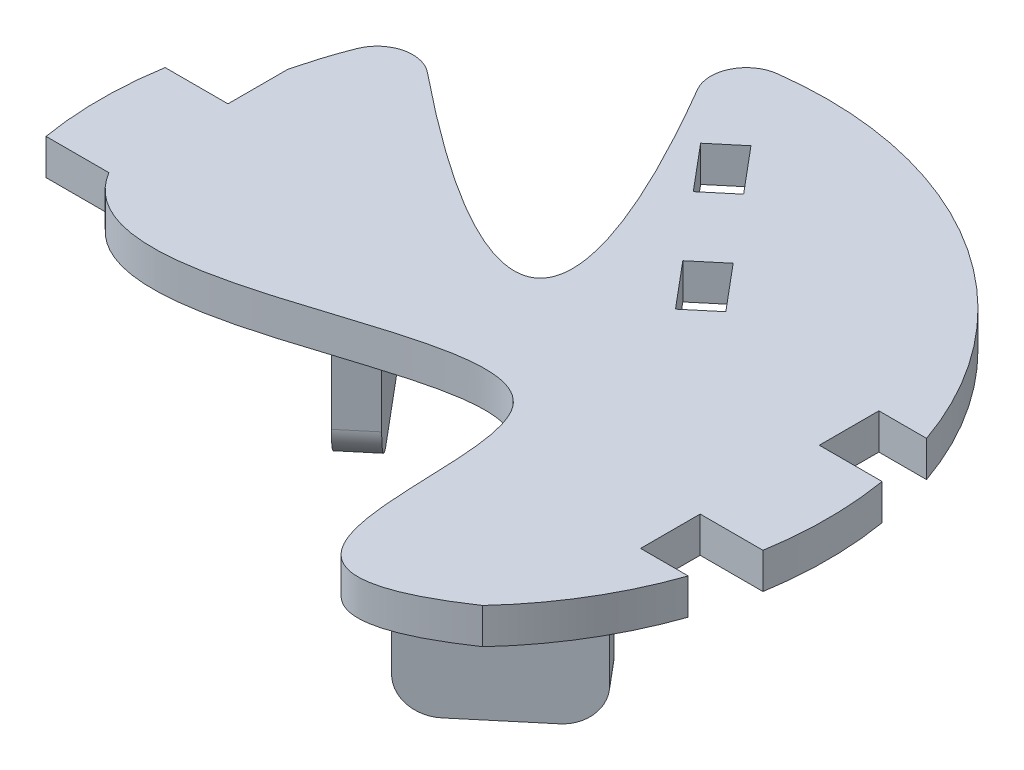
SolidWorks part; units mm, degrees
ref_plane "Alzado" through (0, 0, 0) normal (0, 0, 1) x (1, 0, 0)
ref_plane "Planta" through (0, 0, 0) normal (0, 1, 0) x (1, 0, 0)
ref_plane "Vista lateral" through (0, 0, 0) normal (1, 0, 0) x (0, 0, -1)
sketch "Croquis1" plane through (0, 0, 0) normal (0, 1, 0) x (1, 0, 0)
  circle A0 centre (0, 0) radius 30.5
extrude "Saliente-Extruir1" add sketch "Croquis1" along normal blind 3
sketch "Croquis5" plane through (0, 3, 0) normal (0, 1, 0) x (1, 0, 0)
  line L0 (0, 0) -> (0, 10)
  line L1 (28.8141, -5) -> (30.0874, -5)
  line L2 (28.8141, 5) -> (30.0874, 5)
  line L3 (-24.8141, 10) -> (-28.8141, 10)
  line L4 (24.8141, -5) -> (24.8141, -10)
  line L5 (-24.8141, -10) -> (-28.8141, -10)
  line L6 (24.8141, -5) -> (28.8141, -5)
  line L7 (24.8141, 5) -> (24.8141, 10)
  line L8 (-24.8141, 5) -> (-28.8141, 5)
  line L9 (-24.8141, 5) -> (-24.8141, 10)
  line L10 (-24.8141, -5) -> (-28.8141, -5)
  line L11 (-24.8141, -5) -> (-24.8141, -10)
  line L12 (24.8141, 5) -> (28.8141, 5)
  line L13 (24.8141, -10) -> (28.8141, -10)
  line L14 (24.8141, 10) -> (28.8141, 10)
  line L15 (-28.8141, 5) -> (-30.0874, 5)
  line L16 (-28.8141, -5) -> (-30.0874, -5)
  circle A1 centre (0, 0) radius 30.5 construction
  arc A2 (-28.8141, 10) -> (-30.0874, 5) centre (0, 0) ccw
  arc A3 (28.8141, 10) -> (28.8141, -10) centre (0, 0) cw
  arc A4 (-30.0874, -5) -> (-28.8141, -10) centre (0, 0) ccw
  arc A5 (30.0874, -5) -> (28.8141, -10) centre (0, 0) cw
  arc A6 (28.8141, 10) -> (30.0874, 5) centre (0, 0) cw
extrude "Cortar-Extruir3" cut sketch "Croquis5" against normal blind 4
sketch "Croquis9" plane through (0, 3, 0) normal (0, 1, 0) x (1, 0, 0)
  line L0 (7.2803, 10.7703) -> (22.8679, -7.8063)
  line L1 (-8.3073, 29.3469) -> (7.2803, 10.7703)
  line L2 (7.9714, 14.6138) -> (11.1854, 10.7835)
  line L3 (-24.8141, -5) -> (-24.8141, -10)
  line L4 (-24.8141, -10) -> (-28.8141, -10)
  line L5 (11.1854, 10.7835) -> (8.8872, 8.8552)
  line L7 (7.9714, 14.6138) -> (5.6733, 12.6854)
  line L11 (-2.1205, 21.9737) -> (1.0934, 18.1435)
  line L12 (0.1776, 23.902) -> (3.3916, 20.0718)
  line L13 (-24.8141, 10) -> (-28.8141, 10)
  line L14 (3.3916, 20.0718) -> (1.0934, 18.1435)
  line L15 (0.1776, 23.902) -> (-2.1205, 21.9737)
  arc A1 (28.8141, 10) -> (-28.8141, 10) centre (0, 0) ccw construction
  arc A5 (-28.8141, -10) -> (28.8141, -10) centre (0, 0) ccw construction
  arc A6 (-23.4189, 14.4323) -> (-18.7453, 15.6646) centre (-20.6289, 13.3296) cw
  arc A7 (-28.8141, -10) -> (22.3289, -20.7766) centre (0, 0) ccw
  arc A8 (-28.8141, 10) -> (-8.3073, 29.3469) centre (0, 0) cw
  spline S0 degree 3 poles (22.3289, -20.7766) (5.9738, -31.8512) (22.1768, 15.8352) (-18.2069, -15.8076) (-24.8141, -5) knots 0 0 0 0 0.44579 1 1 1 1
  spline S1 degree 3 poles (-24.8141, -5) (-26.3603, 1.5896) (-25.8363, 8.3159) (-23.4189, 14.4323) knots 0 0 0 0 0.831813 0.831813 0.831813 0.831813
  spline S2 degree 3 poles (-18.7453, 15.6646) (3.867, -2.5765) (8.0942, 2.4964) (-8.3073, 29.3469) knots 0.040528 0.040528 0.040528 0.040528 1 1 1 1
  dimension "D1" = 3
extrude "Cortar-Extruir6" cut sketch "Croquis9" against normal blind 10
sketch "Croquis10" plane through (0, 3, 0) normal (0, 1, 0) x (1, 0, 0)
  line L0 (-4.5186, -2.3936) -> (-6.8167, -4.322)
  line L1 (-4.5186, -2.3936) -> (-14.1604, 9.0971)
  line L2 (-6.8167, -4.322) -> (-16.4585, 7.1687)
  line L3 (-14.1604, 9.0971) -> (-16.4585, 7.1687)
  line L4 (21.5273, -8.9312) -> (23.4556, -11.2293)
  line L5 (21.5273, -8.9312) -> (11.5687, -17.2874)
  line L6 (23.4556, -11.2293) -> (13.4971, -19.5855)
  line L7 (11.5687, -17.2874) -> (13.4971, -19.5855)
  line L8 (17.6971, -12.1451) -> (21.5273, -8.9312) construction
  line L9 (21.5273, -8.9312) -> (23.4556, -11.2293) construction
extrude "Saliente-Extruir2" add sketch "Croquis10" against normal blind 13
fillet "Redondeo1" radius 3 1 edges at (-8.3073, 1.5, -29.3469)
fillet "Redondeo2" radius 3 2 edges at (-5.6676, -10, 3.3578) (-15.3094, -10, -8.1329)
fillet "Redondeo3" radius 3 2 edges at (22.4915, -10, 10.0802) (12.5329, -10, 18.4365)
fillet "Redondeo6" radius 1 6 edges at (12.5329, 0, 18.4365) (22.4915, 0, 10.0802) (18.4763, 0, 15.4074) (-5.6676, 0, 3.3578) (-11.6376, 0, -1.4234) (-15.3094, 0, -8.1329)
